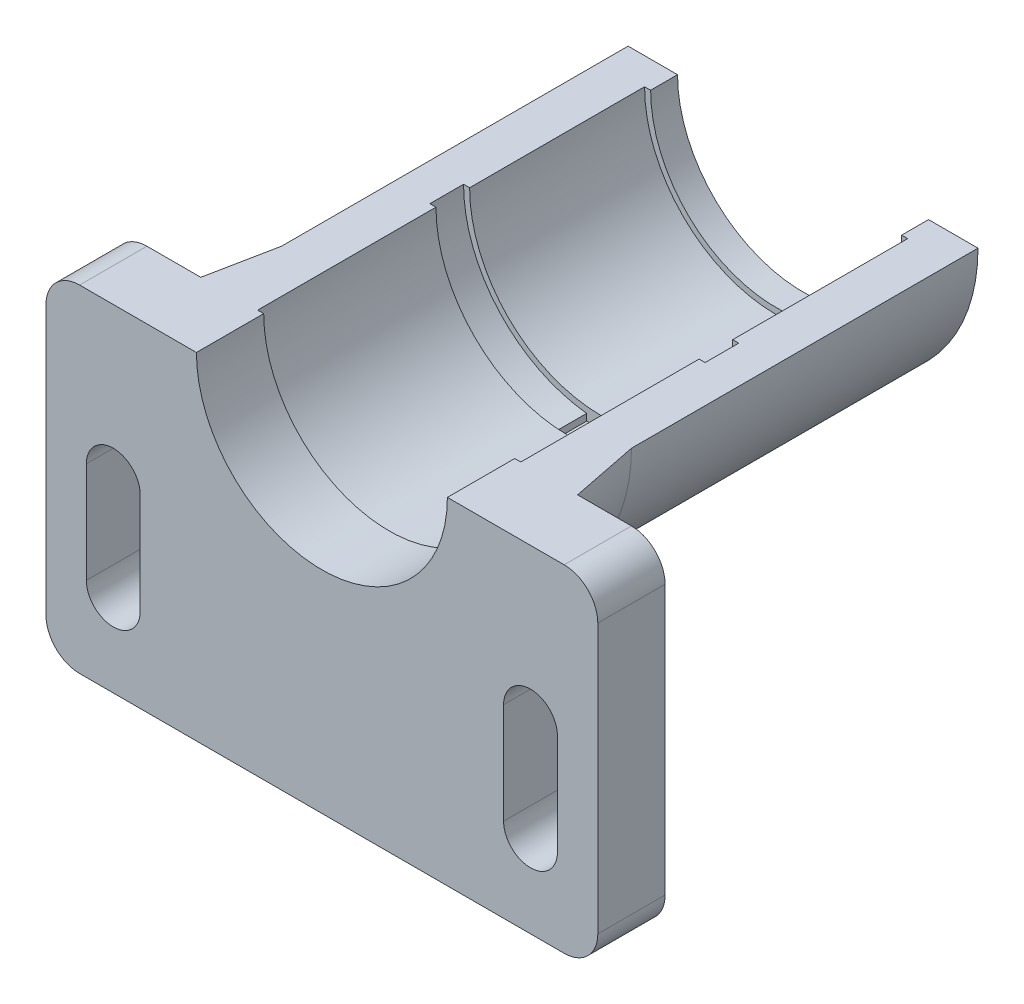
SolidWorks part; units mm, degrees
ref_plane "Plan de face" through (0, 0, 0) normal (0, 0, 1) x (1, 0, 0)
ref_plane "Plan de dessus" through (0, 0, 0) normal (0, 1, 0) x (1, 0, 0)
ref_plane "Plan de droite" through (0, 0, 0) normal (1, 0, 0) x (0, 0, -1)
sketch "Esquisse1" plane through (0, 0, 0) normal (0, 0, 1) x (1, 0, 0)
  line L0 (-26, 0) -> (-19.55, 0)
  line L1 (19.55, 0) -> (26, 0)
  line L2 (0, 0) -> (19.55, 0) construction
  line L3 (0, 0) -> (-18, 0) construction
  circle A0 centre (0, 0) radius 18 construction
  arc A1 (26, 0) -> (-26, 0) centre (0, 0) cw
  circle A2 centre (0, 0) radius 19.55 construction
  arc A3 (-19.55, 0) -> (19.55, 0) centre (0, 0) ccw
  dimension "D1" = 36
  dimension "D2" = 8
  dimension "D4" = 1.55
extrude "Boss.-Extru.1" add sketch "Esquisse1" along normal blind 57.5
sketch "Esquisse2" plane through (0, 0, 57.5) normal (0, 0, 1) x (1, 0, 0)
  line L0 (-41, 0) -> (-18.65, 0)
  line L2 (-41, 0) -> (-41, -50)
  line L3 (-41, -50) -> (41, -50)
  line L4 (41, 0) -> (41, -50)
  line L5 (26, 0) -> (19.55, 0) construction
  line L6 (18.65, 0) -> (41, 0)
  arc A0 (-26, 0) -> (26, 0) centre (0, 0) ccw construction
  arc A1 (-19.55, 0) -> (19.55, 0) centre (0, 0) ccw construction
  arc A2 (-18.65, 0) -> (18.65, 0) centre (0, 0) ccw
  dimension "D4" = 0.9
  dimension "D1" = 15
  dimension "D2" = 15
  dimension "D3" = 50
extrude "Boss.-Extru.2" add sketch "Esquisse2" along normal blind 10
sketch "Esquisse3" plane through (0, 0, 57.5) normal (0, 0, -1) x (-1, 0, 0)
  line L0 (41, 0) -> (41, -50)
  line L1 (41, -50) -> (-41, -50)
  line L2 (-41, -50) -> (-41, 0)
  line L3 (-41, 0) -> (-26, 0)
  line L4 (26, 0) -> (41, 0) construction
  line L10 (41, 0) -> (26, 0)
  line L11 (-26, 0) -> (-41, 0)
  line L12 (-41, 0) -> (-41, -50)
  line L13 (-41, -50) -> (41, -50)
  line L14 (41, -50) -> (41, 0)
  line L15 (41, 0) -> (26, 0)
  arc A0 (-26, 0) -> (26, 0) centre (0, 0) ccw
  arc A2 (-26, 0) -> (26, 0) centre (0, 0) ccw
  dimension "D1" = 0
sketch "Esquisse5" plane through (0, 0, 0) normal (0, 0, -1) x (-1, 0, 0)
  line L0 (-26, 0) -> (-19.55, 0) construction
  line L2 (19.55, 0) -> (26, 0) construction
  line L3 (20.45, 0) -> (19.55, 0)
  line L4 (-20.45, 0) -> (-19.55, 0)
  line L5 (-2.15, -21.3367) -> (2.15, -21.3367)
  line L6 (2.15, -21.3367) -> (2.15, -20.3367)
  line L7 (-2.15, -21.3367) -> (-2.15, -20.3367)
  arc A1 (-19.55, 0) -> (19.55, 0) centre (0, 0) ccw
  arc A2 (-20.45, 0) -> (20.45, 0) centre (0, 0) ccw
  arc A3 (-20.45, 0) -> (-2.15, -20.3367) centre (0, 0) ccw
  arc A4 (-19.55, 0) -> (19.55, 0) centre (0, 0) ccw construction
  arc A5 (2.15, -20.3367) -> (20.45, 0) centre (0, 0) ccw
  point P13 (0, -19.55)
  point P20 (0, -21.3367)
  dimension "D2" = 4.3
  dimension "D3" = 1
  dimension "D1" = 0.9
extrude "Enlèv. mat.-Extru.1" cut sketch "Esquisse5" against normal blind 5 from offset 26 contours A3 M5 M3 M4
sketch "Esquisse6" plane through (0, 0, 67.5) normal (0, 0, 1) x (1, 0, 0)
  line L0 (-41, -50) -> (41, -50) construction
  line L1 (-41, 0) -> (-41, -50) construction
  line L2 (41, -50) -> (41, 0) construction
  line L3 (31, -37.5) -> (31, -22.5) construction
  line L4 (27, -37.5) -> (27, -22.5)
  line L5 (35, -37.5) -> (35, -22.5)
  line L6 (0, 0) -> (0, -73.8493) construction
  line L7 (-31, -37.5) -> (-31, -22.5) construction
  line L8 (-27, -37.5) -> (-27, -22.5)
  line L9 (-35, -37.5) -> (-35, -22.5)
  circle A0 centre (-31, -30) radius 4 construction
  circle A1 centre (31, -30) radius 4 construction
  arc A2 (27, -37.5) -> (35, -37.5) centre (31, -37.5) ccw
  arc A3 (35, -22.5) -> (27, -22.5) centre (31, -22.5) ccw
  arc A4 (-27, -37.5) -> (-35, -37.5) centre (-31, -37.5) cw
  arc A5 (-35, -22.5) -> (-27, -22.5) centre (-31, -22.5) cw
  point P10 (31, -30)
  point P19 (-31, -30)
  dimension "D1" = 8
  dimension "D2" = 8
  dimension "D3" = 20
  dimension "D4" = 10
  dimension "D5" = 10
  dimension "D6" = 8
  dimension "D7" = 15
extrude "Enlèv. mat.-Extru.2" cut sketch "Esquisse6" against normal through all
sketch "Esquisse4" plane through (0, 0, 0) normal (0, 0, -1) x (-1, 0, 0)
  line L0 (-18.65, 0) -> (-26, 0)
  line L1 (19.55, 0) -> (26, 0) construction
  line L2 (26, 0) -> (18.65, 0)
  arc A0 (-18.65, 0) -> (18.65, 0) centre (0, 0) ccw
  arc A1 (-26, 0) -> (26, 0) centre (0, 0) ccw
  arc A2 (-18.65, 0) -> (18.65, 0) centre (0, 0) ccw
  arc A3 (-17.7839, 5.6175) -> (18.65, 0) centre (0, 0) ccw construction
  dimension "D1" = 0.9
extrude "Boss.-Extru.4" add sketch "Esquisse4" along normal blind 4
chamfer "Chanfrein1" distance 10 distance2 2 1 edges at (0, -26, 57.5)
fillet "Congé1" radius 5 4 edges at (-41, 0, 62.5) (41, 0, 62.5) (41, -50, 62.5) (-41, -50, 62.5)
